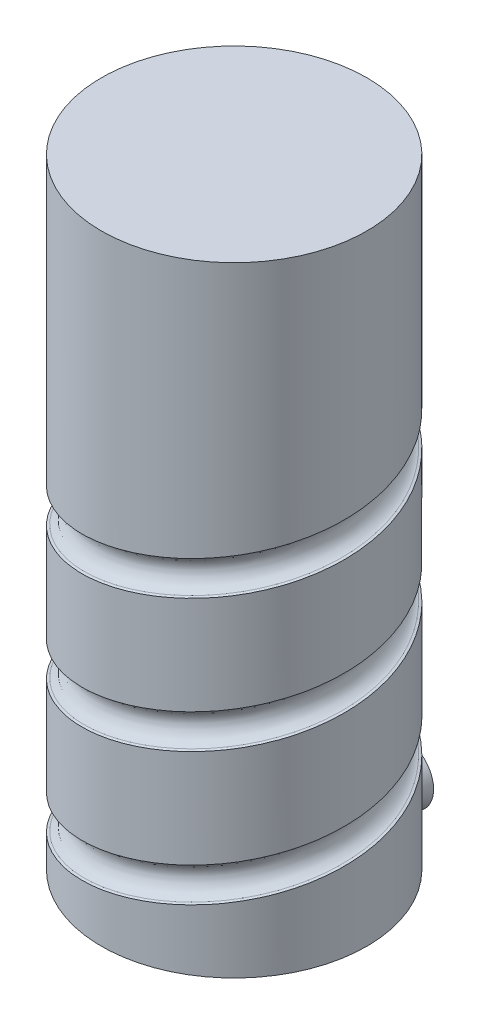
SolidWorks part; units mm, degrees
ref_plane "Front Plane" through (0, 0, 0) normal (0, 0, 1) x (1, 0, 0)
ref_plane "Top Plane" through (0, 0, 0) normal (0, 1, 0) x (1, 0, 0)
ref_plane "Right Plane" through (0, 0, 0) normal (1, 0, 0) x (0, 0, -1)
sketch "Sketch1"
  dimension "D1" = 76.2
extrude "Extrude1" add sketch "Sketch1" along normal blind 177.8
sketch "Sketch5"
revolve "Revolve1" add sketch "Sketch5" angle 360 about L0
sketch "Sketch7"
curve "Helix/Spiral2"
sweep "Cut-Sweep10" cut
